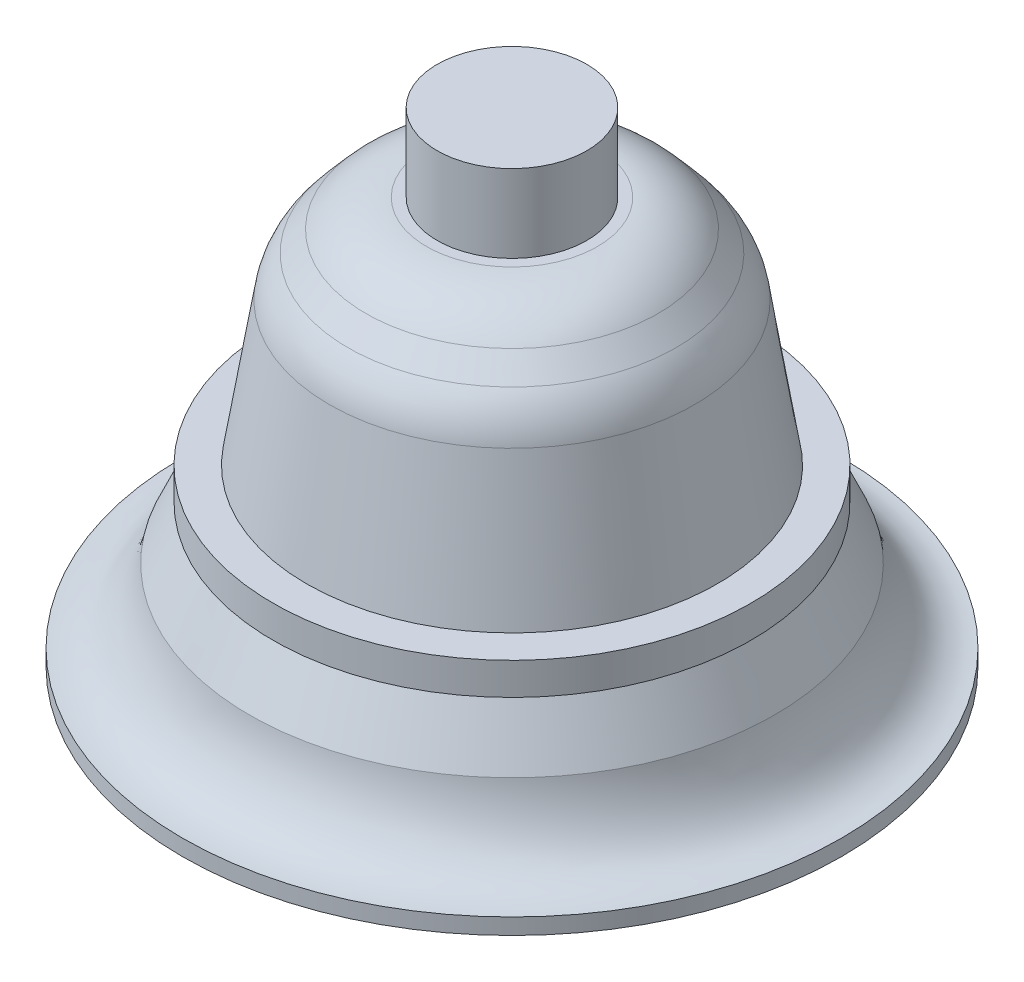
SolidWorks part; units mm, degrees
ref_plane "Alzado" through (0, 0, 0) normal (0, 0, 1) x (1, 0, 0)
ref_plane "Planta" through (0, 0, 0) normal (0, 1, 0) x (1, 0, 0)
ref_plane "Vista lateral" through (0, 0, 0) normal (1, 0, 0) x (0, 0, -1)
sketch "Croquis1" plane through (0, 0, 0) normal (1, 0, 0) x (0, 0, -1)
  line L0 (0, 10.8195) -> (0, 60)
  line L1 (29.7779, 21.4107) -> (29.7779, 17.4052)
  line L2 (41.0499, 1.6952) -> (41.0499, -0.3048)
  line L3 (30.6792, 10.8195) -> (30.7337, 10.5147)
  line L4 (29.7779, 17.4052) -> (32.7103, 10.8195)
  line L8 (30.6792, 10.8195) -> (0, 10.8195)
  line L11 (29.7779, 21.4107) -> (25.599, 21.4107)
  line L12 (25.599, 21.4107) -> (22.7453, 39.3117)
  line L13 (20.4269, 44.2867) -> (18.1961, 46.8606)
  line L14 (10.6392, 50.3113) -> (9.3249, 50.3113)
  line L15 (0, 60) -> (9.3249, 60)
  line L16 (9.3249, 60) -> (9.3249, 50.3113)
  arc A2 (18.1961, 46.8606) -> (10.6392, 50.3113) centre (10.6392, 40.3113) ccw
  arc A3 (22.7453, 39.3117) -> (20.4269, 44.2867) centre (12.87, 37.7374) ccw
  spline S0 degree 1 poles (41.0499, -0.3048) (30.7337, 10.5147) knots 0 0 1 1 construction
  spline S1 degree 3 poles (41.0499, -0.3048) (40.6811, -0.3048) (39.9312, -0.2711) (38.5409, -0.0645) (36.9733, 0.4434) (35.3297, 1.4428) (33.4626, 3.2421) (31.7179, 6.257) (30.9524, 9.0965) (30.7337, 10.5147) knots 0 0 0 0 0.0625 0.125 0.25 0.375 0.5 0.75 1 1 1 1
  spline S2 degree 3 poles (41.0499, 1.6952) (40.7438, 1.6952) (40.1123, 1.724) (39.0127, 1.8892) (37.8073, 2.2814) (36.5703, 3.0336) (35.1005, 4.4396) (33.6588, 6.8909) (32.9608, 9.3542) (32.7425, 10.6165) (32.7221, 10.7432) (32.7103, 10.8195) knots 0 0 0 0 0.0625 0.125 0.25 0.375 0.5 0.75 0.974805 0.984883 1 1 1 1
  dimension "D5" = 10
  dimension "D1" = 2
revolve "Revolución1" add sketch "Croquis1" angle 360 about L0
shell "Vaciado1" thickness 2
sketch "Croquis2" plane through (0, 19.4107, 0) normal (0, -1, 0) x (1, 0, 0)
  circle A0 centre (0, 0) radius 27.7779
extrude "Saliente-Extruir1" add sketch "Croquis2" along normal blind 1
ref_plane "Plano1" through (0, 0, 20) normal (0, 0, 1) x (1, 0, 0)
